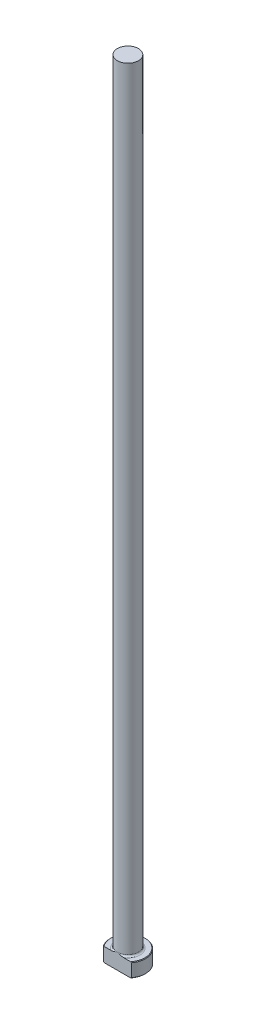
SolidWorks part; units mm, degrees
ref_plane "Front Plane" through (0, 0, 0) normal (0, 0, 1) x (1, 0, 0)
ref_plane "Top Plane" through (0, 0, 0) normal (0, 1, 0) x (1, 0, 0)
ref_plane "Right Plane" through (0, 0, 0) normal (1, 0, 0) x (0, 0, -1)
sketch "Sketch1" plane through (0, 0, 0) normal (0, 0, 1) x (1, 0, 0)
  line L0 (0, 259.9588) -> (0, -15.1925) construction
  line L1 (0, 0) -> (-7.9375, 0)
  line L2 (-7.9375, 0) -> (-7.9375, 6.35)
  line L3 (-7.9375, 6.35) -> (-4.7625, 6.35)
  line L4 (-4.7625, 6.35) -> (-4.7625, 355.6)
  line L5 (-4.7625, 355.6) -> (0, 355.6)
  line L6 (0, 355.6) -> (0, 0)
  dimension "L" = 355.6
  dimension "H" = 15.875
  dimension "T" = 6.35
  dimension "D" = 9.525
revolve "Revolve1" add sketch "Sketch1" angle 360 about L0
chamfer "Chamfer1" distance 0.254 angle 45 2 edges at (0, 6.35, 7.9375) (0, 0, 7.9375)
fillet "Fillet1" radius 0.762 1 edges at (0, 6.35, 4.7625)
sketch "Sketch2" plane through (0, 0, 0) normal (0, -1, 0) x (1, 0, 0)
  line L0 (-6.35, 4.7625) -> (6.35, 4.7625)
  arc A0 (6.35, 4.7625) -> (-6.35, 4.7625) centre (0, 0) ccw
  circle A1 centre (0, 0) radius 7.9375 construction
  circle A3 centre (0, 0) radius 4.7625 construction
extrude "KEY" cut sketch "Sketch2" against normal through all
sketch "Pocket Sketch" plane through (0, 0, 0) normal (0, 0, 1) x (1, 0, 0)
  line L0 (-8.3344, 0) -> (-8.3344, 6.3754)
  line L1 (-8.3344, 6.3754) -> (-5.9214, 6.3754)
  line L2 (-5.1594, 7.1374) -> (-5.1594, 22.225)
  line L3 (-5.1594, 22.225) -> (0, 22.225)
  line L4 (0, 22.225) -> (0, 0)
  line L5 (0, 0) -> (-8.3344, 0)
  line L6 (0, 12.6104) -> (0, -2.4989) construction
  line L7 (-7.9375, 6.096) -> (-7.9375, 0.254) construction
  line L8 (7.6835, 6.35) -> (-7.6835, 6.35) construction
  line L9 (-4.7625, 355.6) -> (-4.7625, 7.112) construction
  line L10 (-5.9214, 6.3754) -> (-5.1594, 7.1374)
  point P3 (-5.1594, 6.3754)
  dimension "D1" = 16.6687
  dimension "D2" = 0.3969
  dimension "D3" = 0.0254
  dimension "D4" = 0.3969
  dimension "D5" = 10.3187
  dimension "D6" = 22.225
